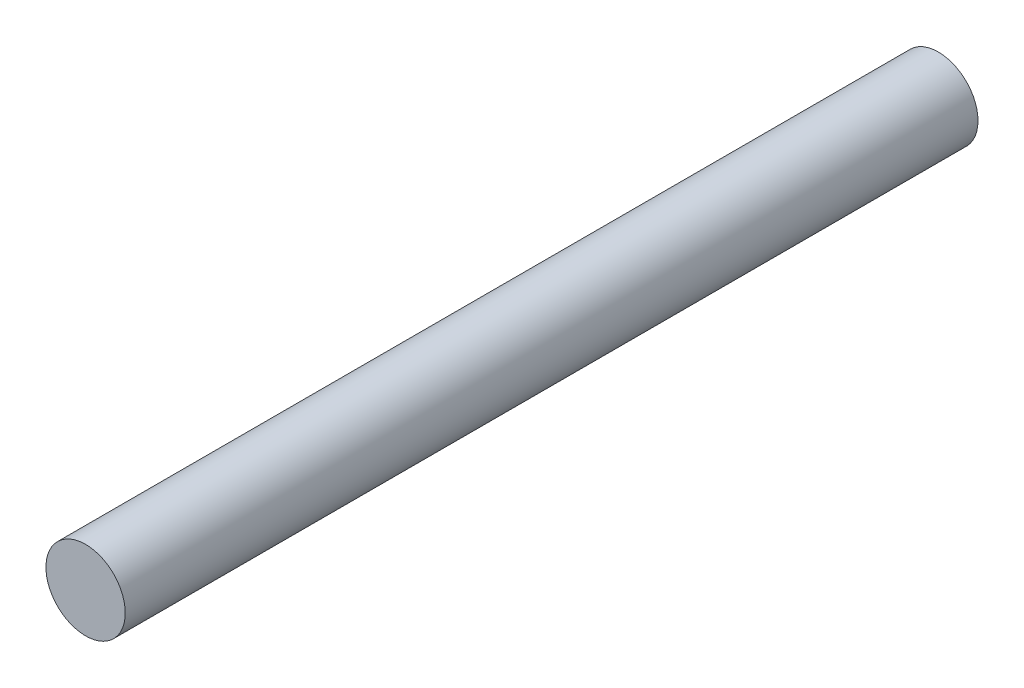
SolidWorks part; units mm, degrees
ref_plane "前视基准面" through (0, 0, 0) normal (0, 0, 1) x (1, 0, 0)
ref_plane "上视基准面" through (0, 0, 0) normal (0, 1, 0) x (1, 0, 0)
ref_plane "右视基准面" through (0, 0, 0) normal (1, 0, 0) x (0, 0, -1)
sketch "草图1" plane through (0, 0, 0) normal (0, 0, 1) x (1, 0, 0)
  circle A0 centre (0, 0) radius 2
  dimension "D1" = 4
extrude "凸台-拉伸1" add sketch "草图1" along normal mid plane 43
sketch "草图3" plane through (0, 0, 0) normal (1, 0, 0) x (0, 0, -1)
  line L0 (-21.5, 0) -> (21.5, 0) construction
  line L1 (-21.5, 2) -> (-21.5, -2) construction
  line L2 (21.5, -2) -> (21.5, 2) construction
